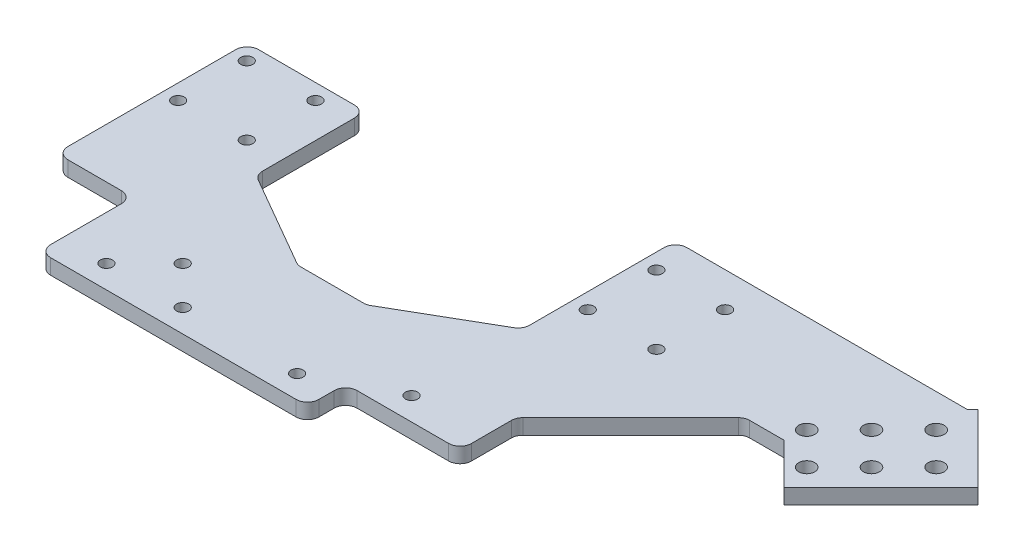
SolidWorks part; units mm, degrees
ref_plane "前视基准面" through (0, 0, 0) normal (0, 0, 1) x (1, 0, 0)
ref_plane "上视基准面" through (0, 0, 0) normal (0, 1, 0) x (1, 0, 0)
ref_plane "右视基准面" through (0, 0, 0) normal (1, 0, 0) x (0, 0, -1)
sketch "草图1" plane through (0, 0, 0) normal (0, 1, 0) x (1, 0, 0)
  line L0 (-63.1, -24.3) -> (-15.5, -24.3) construction
  line L1 (-56.1, -85.7) -> (44.22, -85.7)
  line L2 (44.22, -85.7) -> (44.22, -61)
  line L3 (44.22, -61) -> (74.22, -31)
  line L4 (74.22, -31) -> (103.92, -31)
  line L5 (103.92, -31) -> (103.92, 0)
  line L6 (103.92, 0) -> (25, 0)
  line L7 (15.5, -15.5) -> (140.9432, -15.5) construction
  line L8 (15.5, -15.5) -> (15.5, -86.0824) construction
  line L9 (25, 0) -> (25, -55)
  line L10 (-72.1, -15.3) -> (-54.1, -15.3) construction
  line L11 (-72.1, -15.3) -> (-72.1, -33.3) construction
  line L12 (-72.1, -33.3) -> (-54.1, -33.3) construction
  line L13 (-54.1, -15.3) -> (-54.1, -33.3) construction
  line L14 (-72.1, -15.3) -> (-54.1, -33.3) construction
  line L15 (-72.1, -33.3) -> (-54.1, -15.3) construction
  line L16 (29.1, -9.1) -> (47.1, -9.1) construction
  line L17 (29.1, -9.1) -> (29.1, -27.1) construction
  line L18 (29.1, -27.1) -> (47.1, -27.1) construction
  line L19 (47.1, -9.1) -> (47.1, -27.1) construction
  line L20 (29.1, -9.1) -> (47.1, -27.1) construction
  line L21 (29.1, -27.1) -> (47.1, -9.1) construction
  line L22 (25, -55) -> (-45, -55)
  line L23 (-45, -55) -> (-45, -11.2)
  line L24 (-45, -11.2) -> (-76.1, -11.2)
  line L25 (-76.1, -11.2) -> (-76.1, -61.2)
  line L26 (-76.1, -61.2) -> (-56.1, -61.2)
  line L27 (-56.1, -61.2) -> (-56.1, -85.7)
  line L28 (-15.5, -24.3) -> (-15.5, 29.3) construction
  line L29 (-15.5, 29.3) -> (38.1, 29.3) construction
  line L30 (38.1, 29.3) -> (38.1, -18.1) construction
  circle A0 centre (5.5, -79.7) radius 1.6
  circle A1 centre (25.5, -79.7) radius 1.6
  circle A2 centre (25.5, -69.7) radius 1.6
  circle A3 centre (97.92, -5.5) radius 1.6 construction
  circle A4 centre (97.92, -25.5) radius 1.6 construction
  circle A5 centre (87.92, -15.5) radius 1.6 construction
  circle A6 centre (-72.1, -15.3) radius 1.6
  circle A7 centre (-54.1, -15.3) radius 1.6
  circle A8 centre (-54.1, -33.3) radius 1.6
  circle A9 centre (-72.1, -33.3) radius 1.6
  circle A10 centre (47.1, -27.1) radius 1.6
  circle A11 centre (47.1, -9.1) radius 1.6
  circle A12 centre (29.1, -9.1) radius 1.6
  circle A13 centre (29.1, -27.1) radius 1.6
  circle A14 centre (-24.5, -79.7) radius 1.6
  circle A15 centre (-44.5, -79.7) radius 1.6
  circle A16 centre (-34.5, -69.7) radius 1.6
  point P23 (-63.1, -24.3)
  point P33 (38.1, -18.1)
  dimension "D9" = 3.2
  dimension "D14" = 3.2
  dimension "D17" = 3.2
  dimension "D21" = 3.2
  dimension "D36" = 3.2
  dimension "D3" = 31
  dimension "D4" = 103.92
  dimension "D5" = 30
  dimension "D6" = 30
  dimension "D7" = 6
  dimension "D8" = 10
  dimension "D10" = 20
  dimension "D11" = 20
  dimension "D12" = 10
  dimension "D13" = 6
  dimension "D15" = 18
  dimension "D16" = 18
  dimension "D18" = 25
  dimension "D19" = 18
  dimension "D20" = 18
  dimension "D22" = 55
  dimension "D23" = 9.1
  dimension "D24" = 29.7
  dimension "D25" = 70
  dimension "D26" = 9.1
  dimension "D27" = 47.4
  dimension "D28" = 47.6
  dimension "D29" = 15.5
  dimension "D30" = 85.7
  dimension "D31" = 13.1
  dimension "D32" = 13.1
  dimension "D33" = 50
  dimension "D34" = 20
  dimension "D35" = 13
  dimension "D37" = 30
  dimension "D38" = 20
  dimension "D39" = 10
  dimension "D40" = 10
  dimension "D41" = 20
extrude "凸台-拉伸1" add sketch "草图1" along normal blind 4
sketch "草图2" plane through (0, 4, 0) normal (0, 1, 0) x (1, 0, 0)
  line L1 (44.22, -85.7) -> (14.22, -85.7)
  line L2 (44.22, -85.7) -> (44.22, -75.7)
  line L3 (44.22, -75.7) -> (14.22, -75.7)
  line L4 (14.22, -85.7) -> (14.22, -75.7)
  dimension "D1" = 30
  dimension "D2" = 10
extrude "切除-拉伸1" cut sketch "草图2" against normal up to next
chamfer "倒角1" distance 15 angle 60 2 edges at (-45, 2, 55) (25, 2, 55)
fillet "圆角1" radius 3 15 edges at (74.22, 2, 31) (44.22, 2, 61) (-56.1, 2, 85.7) (-56.1, 2, 61.2) (-76.1, 2, 61.2) (-76.1, 2, 11.2) (-45, 2, 11.2) (-45, 2, 40) (-19.0192, 2, 55) (-0.9808, 2, 55) (25, 2, 40) (25, 2, 0) (44.22, 2, 75.7) (14.22, 2, 85.7) (14.22, 2, 75.7)
sketch "草图3" plane through (0, 0, 0) normal (0, -1, 0) x (1, 0, 0)
  line L0 (-15.5, -29.3) -> (66.5244, 52.7244) construction
  line L1 (-15.5, -29.3) -> (38.1, -29.3) construction
  line L2 (66.5244, 52.7244) -> (103.8344, 15.4144) construction
  line L4 (77.4845, 24.0866) -> (102.9404, -1.3693)
  line L5 (95.1622, 41.7642) -> (120.6181, 16.3084)
  line L6 (75.3632, 61.5632) -> (112.6732, 24.2532) construction
  line L7 (57.6856, 43.8856) -> (94.9956, 6.5756) construction
  line L8 (120.6181, 16.3084) -> (102.9404, -1.3693)
  line L9 (95.1622, 41.7642) -> (77.4845, 24.0866)
  point P12 (82.8984, 54.1992)
  point P13 (88.7742, 48.3234)
  dimension "D1" = 45
  dimension "D4" = 28
  dimension "D5" = 36
  dimension "D6" = 116
  dimension "D2" = 12.5
  dimension "D3" = 12.5
extrude "凸台-拉伸2" add sketch "草图3" against normal through all
sketch "草图4" plane through (0, 0, 0) normal (0, -1, 0) x (1, 0, 0)
  line L0 (111.7792, 7.4696) -> (86.3234, 32.9254) construction
  line L1 (102.9404, -1.3693) -> (120.6181, 16.3084) construction
  line L2 (95.1622, 41.7642) -> (84.398, 31) construction
  line L3 (85.0859, 25.6776) -> (93.5712, 34.1628) construction
  line L4 (93.5712, 17.1923) -> (102.0565, 25.6776) construction
  line L5 (102.0565, 8.707) -> (110.5418, 17.1923) construction
  circle A0 centre (93.5712, 34.1628) radius 2.1
  circle A1 centre (85.0859, 25.6776) radius 2.1
  circle A2 centre (110.5418, 17.1923) radius 2.1
  circle A3 centre (102.0565, 25.6776) radius 2.1
  circle A4 centre (93.5712, 17.1923) radius 2.1
  circle A5 centre (102.0565, 8.707) radius 2.1
  point P11 (89.3286, 29.9202)
  point P14 (97.8139, 21.4349)
  point P17 (106.2991, 12.9496)
  dimension "D3" = 4.2
  dimension "D1" = 12
  dimension "D2" = 4.25
  dimension "D4" = 12
  dimension "D5" = 12
extrude "切除-拉伸2" cut sketch "草图4" against normal through all
